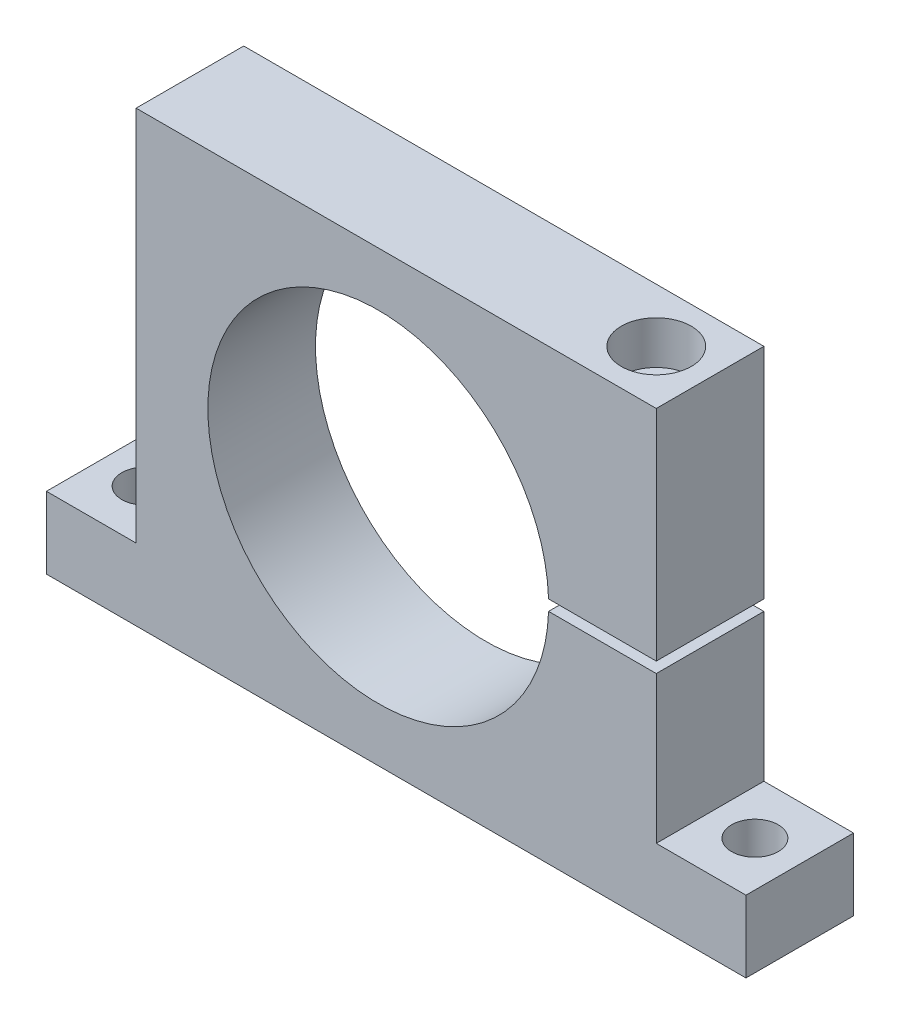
SolidWorks part; units mm, degrees
ref_plane "Front Plane" through (0, 0, 0) normal (0, 0, 1) x (1, 0, 0)
ref_plane "Top Plane" through (0, 0, 0) normal (0, 1, 0) x (1, 0, 0)
ref_plane "Right Plane" through (0, 0, 0) normal (1, 0, 0) x (0, 0, -1)
sketch "Sketch1" plane through (0, 0, 0) normal (0, 0, 1) x (1, 0, 0)
  line L0 (-67.5, 0) -> (77.5, 0) construction
  line L1 (0, 62.5) -> (0, -62.5) construction
  line L2 (-67.5, 62.5) -> (77.5, 62.5)
  line L3 (77.5, 62.5) -> (77.5, 1.5)
  line L4 (77.5, -42.5) -> (102.5, -42.5)
  line L5 (102.5, -42.5) -> (102.5, -62.5)
  line L6 (102.5, -62.5) -> (-92.5, -62.5)
  line L7 (-92.5, -62.5) -> (-92.5, -42.5)
  line L8 (-92.5, -42.5) -> (-67.5, -42.5)
  line L9 (-67.5, -42.5) -> (-67.5, 62.5)
  line L10 (77.5, 1.5) -> (47.4763, 1.5)
  line L11 (77.5, -1.5) -> (47.4763, -1.5)
  line L12 (77.5, -1.5) -> (77.5, -42.5)
  arc A0 (47.4763, 1.5) -> (47.4763, -1.5) centre (0, 0) ccw
  dimension "D1" = 95
  dimension "D2" = 67.5
  dimension "D3" = 25
  dimension "D4" = 125
  dimension "D5" = 20
  dimension "D7" = 62.5
  dimension "D9" = 195
  dimension "D11" = 3
extrude "Boss-Extrude1" add sketch "Sketch1" along normal mid plane 30
sketch "Sketch2" plane through (0, -62.5, 0) normal (0, -1, 0) x (1, 0, 0)
  line L0 (-92.5, 0) -> (102.5, 0) construction
  line L1 (-92.5, 15) -> (-92.5, -15) construction
  line L2 (102.5, 15) -> (102.5, -15) construction
  circle A0 centre (-80, 0) radius 6.5
  circle A1 centre (90, 0) radius 6.5
  dimension "D3" = 13
  dimension "D1" = 170
  dimension "D2" = 12.5
extrude "Cut-Extrude1" cut sketch "Sketch2" against normal blind 20
sketch "Sketch3" plane through (0, 0, 0) normal (0, 0, 1) x (1, 0, 0)
  line L0 (62.5, 62.5) -> (62.5, -62.5) construction
  line L1 (77.5, 62.5) -> (-67.5, 62.5) construction
  line L2 (-92.5, -62.5) -> (102.5, -62.5) construction
  line L3 (62.5, 62.5) -> (72.25, 62.5)
  line L4 (72.25, 62.5) -> (72.25, 50.5)
  line L5 (72.25, 50.5) -> (68.5, 50.5)
  line L6 (68.5, 50.5) -> (68.5, -47.5)
  line L7 (68.5, -47.5) -> (62.5, -51.1052)
  line L8 (62.5, -51.1052) -> (62.5, 62.5)
  line L9 (102.5, -62.5) -> (102.5, -42.5) construction
  dimension "D1" = 40
  dimension "D2" = 12
  dimension "D3" = 59
  dimension "D4" = 12
  dimension "D5" = 19.5
  dimension "D6" = 110
revolve "Cut-Revolve1" cut sketch "Sketch3" angle 360 about L0
